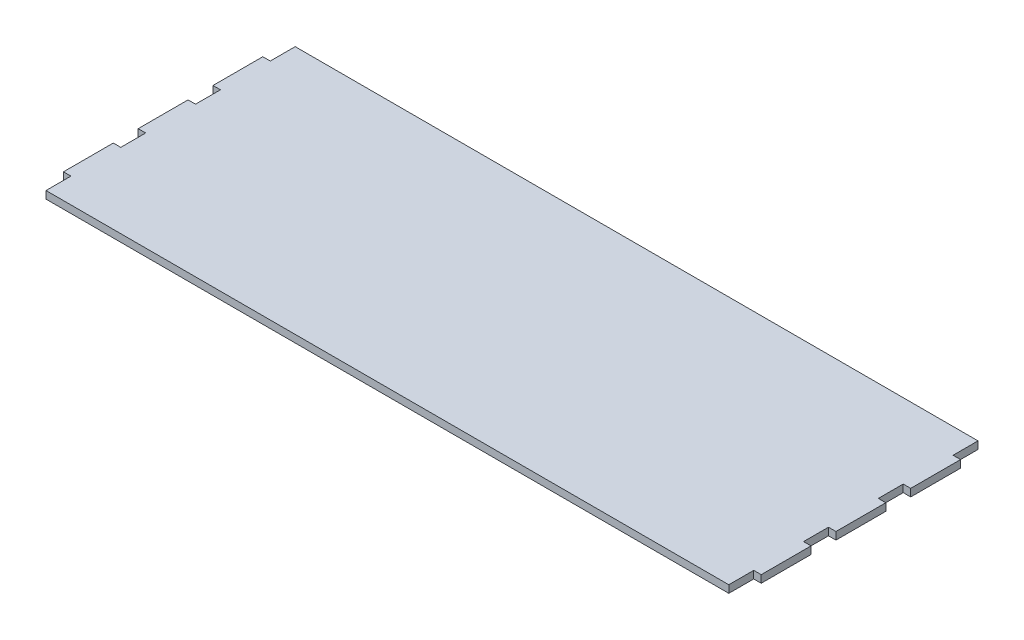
SolidWorks part; units mm, degrees
ref_plane "Alzado" through (0, 0, 0) normal (0, 0, 1) x (1, 0, 0)
ref_plane "Planta" through (0, 0, 0) normal (0, 1, 0) x (1, 0, 0)
ref_plane "Vista lateral" through (0, 0, 0) normal (1, 0, 0) x (0, 0, -1)
sketch "Croquis1" plane through (0, 0, 0) normal (0, 1, 0) x (1, 0, 0)
  line L0 (-560, -40) -> (-560, 40)
  line L1 (-548, -200) -> (548, -200)
  line L2 (-548, -200) -> (-548, -160)
  line L3 (-548, 200) -> (548, 200)
  line L4 (548, -200) -> (548, -160)
  line L5 (-548, -200) -> (548, 200) construction
  line L6 (-548, 200) -> (548, -200) construction
  line L7 (-548, -160) -> (-560, -160)
  line L9 (-548, -80) -> (-560, -80)
  line L10 (-560, -160) -> (-560, -80)
  line L11 (-548, 40) -> (-560, 40)
  line L13 (-548, -40) -> (-560, -40)
  line L14 (-560, 80) -> (-560, 160)
  line L15 (-548, 160) -> (-560, 160)
  line L17 (-548, 80) -> (-560, 80)
  line L18 (0, 200) -> (0, 142.0008) construction
  line L19 (548, -160) -> (560, -160)
  line L21 (548, -80) -> (560, -80)
  line L22 (560, -160) -> (560, -80)
  line L23 (548, -40) -> (560, -40)
  line L25 (548, 40) -> (560, 40)
  line L26 (560, -40) -> (560, 40)
  line L27 (548, 80) -> (560, 80)
  line L29 (548, 160) -> (560, 160)
  line L30 (560, 80) -> (560, 160)
  line L31 (-548, 160) -> (-548, 200)
  line L33 (-548, 40) -> (-548, 80)
  line L35 (-548, -80) -> (-548, -40)
  line L36 (548, 160) -> (548, 200)
  line L37 (548, 40) -> (548, 80)
  line L38 (548, -80) -> (548, -40)
  point P0 (0, 0)
extrude "Saliente-Extruir1" add sketch "Croquis1" along normal blind 12
equation "\"ancho\"=40"
equation "\"D2@Croquis1\"=\"ancho\""
equation "\"largo\"=112"
equation "\"material\"= 1.2"
equation "\"D1@Croquis1\"=\"largo\"-(\"material\"*2)"
equation "\"ancho_joint_sep\"=4"
equation "\"D3@Croquis1\"=\"ancho_joint_sep\""
equation "\"ancho_joint\"=8"
equation "\"D4@Croquis1\"=\"ancho_joint\""
equation "\"D5@Croquis1\"=\"material\""
equation "\"D7@Croquis1\"=\"ancho_joint_sep\""
equation "\"D1@Saliente-Extruir1\"=\"material\""
